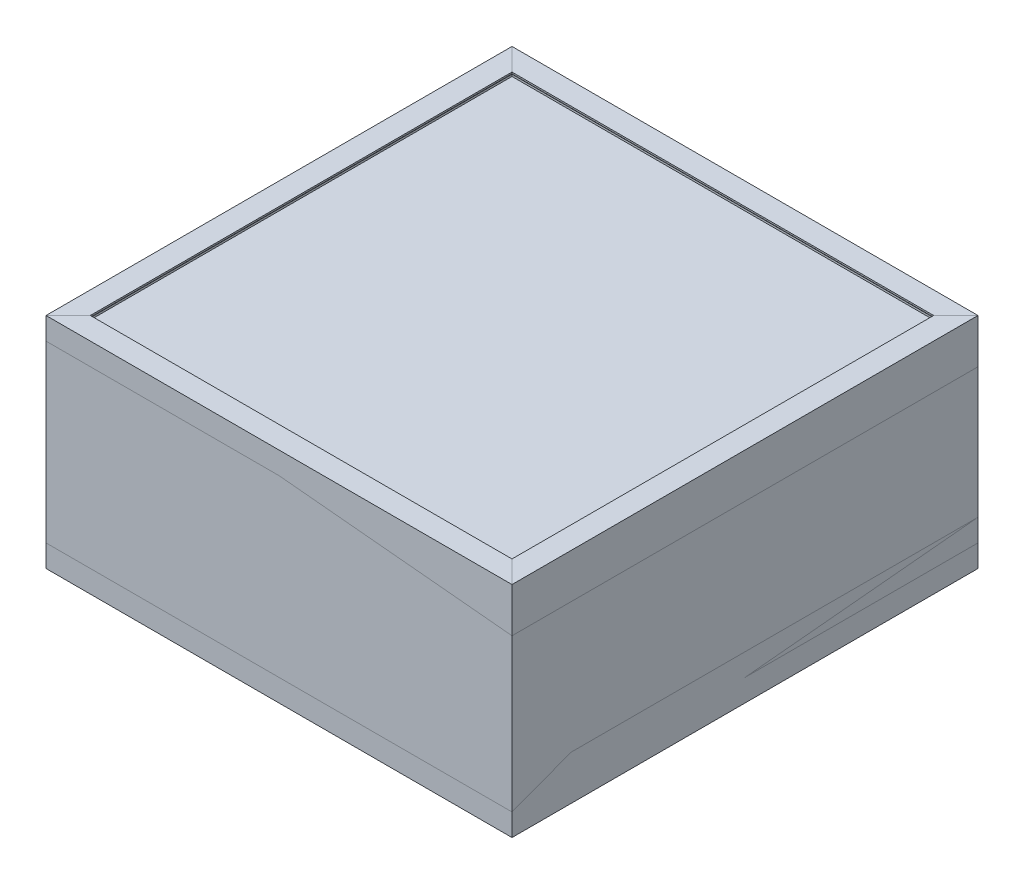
SolidWorks part; units mm, degrees
ref_plane "Front Plane" through (0, 0, 0) normal (0, 0, 1) x (1, 0, 0)
ref_plane "Top Plane" through (0, 0, 0) normal (0, 1, 0) x (1, 0, 0)
ref_plane "Right Plane" through (0, 0, 0) normal (1, 0, 0) x (0, 0, -1)
sketch "Sketch1" plane through (0, 0, 0) normal (0, 1, 0) x (1, 0, 0)
  line L1 (-400, 400) -> (400, 400)
  line L2 (-400, 400) -> (-400, -400)
  line L3 (-400, -400) -> (400, -400)
  line L4 (400, 400) -> (400, -400)
  line L5 (-400, 400) -> (400, -400) construction
  line L6 (-400, -400) -> (400, 400) construction
  point P0 (0, 0)
  dimension "D1" = 800
extrude "Boss-Extrude1" add sketch "Sketch1" along normal blind 300
sketch3d "3DSketch2"
  line L0 (400, 300, -400) -> (400, 0, -400) construction
  line L1 (-400, 300, -400) -> (-400, 0, -400) construction
  line L2 (-400, 300, 400) -> (-400, 0, 400) construction
  line L3 (400, 300, 400) -> (400, 0, 400) construction
  line L4 (-400, 300, 400) -> (400, 300, 400) construction
  line L5 (-400, 300, -400) -> (-400, 300, 400) construction
  line L6 (400, 300, -400) -> (-400, 300, -400) construction
  line L7 (400, 300, 400) -> (400, 300, -400) construction
  line L8 (-400, 0, 400) -> (400, 0, 400) construction
  line L9 (-400, 0, -400) -> (-400, 0, 400) construction
  line L10 (400, 0, -400) -> (-400, 0, -400) construction
  line L11 (400, 0, 400) -> (400, 0, -400) construction
  line L12 (400, 300, -400) -> (400, 0, -400)
  line L13 (-400, 300, -400) -> (-400, 0, -400)
  line L14 (-400, 300, 400) -> (-400, 0, 400)
  line L15 (400, 300, 400) -> (400, 0, 400)
  line L16 (-400, 300, 400) -> (400, 300, 400)
  line L17 (-400, 300, -400) -> (-400, 300, 400)
  line L18 (400, 300, -400) -> (-400, 300, -400)
  line L19 (400, 300, 400) -> (400, 300, -400)
  line L20 (-400, 0, 400) -> (400, 0, 400)
  line L21 (-400, 0, -400) -> (-400, 0, 400)
  line L22 (400, 0, -400) -> (-400, 0, -400)
  line L23 (400, 0, 400) -> (400, 0, -400)
other "Structural Member1"
ref_plane "Plane1" through (-400, 300, -400) normal (0, 0, 1) x (1, 0, 0)
sketch "Sketch11" plane through (-400, 300, -400) normal (0, 0, 1) x (1, 0, 0)
  line L0 (0, -38.1) -> (0, 38.1)
  line L1 (0, 38.1) -> (38.0492, 38.1)
  line L2 (0, -38.1) -> (38.0492, -38.1)
  line L5 (31.75, -31.1658) -> (6.35, -31.1658) construction
  line L6 (0, 0) -> (6.5532, 0) construction
  line L12 (6.5532, 22.7314) -> (6.5532, -22.7314)
  line L15 (38.0492, 38.1) -> (38.0492, 35.9423)
  line L16 (38.0492, -38.1) -> (38.0492, -35.9423)
  line L17 (12.2837, 29.4961) -> (35.9268, 33.4369)
  line L18 (12.2837, -29.4961) -> (35.9268, -33.4369)
  arc A9 (6.5532, -22.7314) -> (12.2837, -29.4961) centre (13.4112, -22.7314) ccw
  arc A10 (6.5532, 22.7314) -> (12.2837, 29.4961) centre (13.4112, 22.7314) cw
  arc A11 (38.0492, 35.9423) -> (35.9268, 33.4369) centre (35.5092, 35.9423) cw
  arc A12 (38.0492, -35.9423) -> (35.9268, -33.4369) centre (35.5092, -35.9423) ccw
  point P4 (38.0492, 33.7907)
  point P5 (38.0492, -33.7907)
  point P6 (3.2766, 0)
  point P7 (19.0246, 38.1)
  point P12 (19.0246, -38.1)
  point P13 (0, 0)
  dimension "RI" = 6.858
  dimension "D2" = 9.463
  dimension "RA" = 2.54
  dimension "Depth" = 76.2
  dimension "BF" = 38.0492
  dimension "TW" = 6.5532
  dimension "flange" = 2.1577
  dimension "TF" = 6.9342
